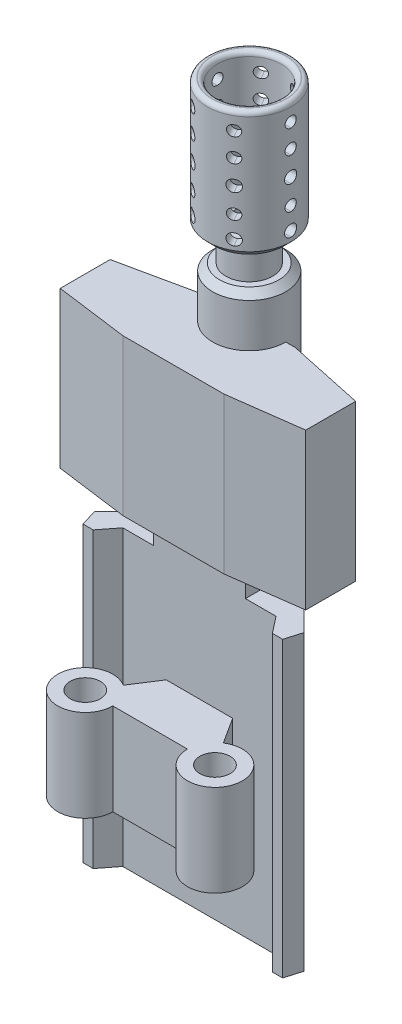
SolidWorks part; units mm, degrees
ref_plane "Front Plane" through (0, 0, 0) normal (0, 0, 1) x (1, 0, 0)
ref_plane "Top Plane" through (0, 0, 0) normal (0, 1, 0) x (1, 0, 0)
ref_plane "Right Plane" through (0, 0, 0) normal (1, 0, 0) x (0, 0, -1)
sketch "Sketch1" plane through (0, 0, 0) normal (0, 1, 0) x (1, 0, 0)
  line L0 (-34.934, 0) -> (-18.634, 0)
  line L1 (-37.6973, 5.0521) -> (-32.621, 12.9754)
  line L2 (-15.8708, 5.0521) -> (-20.9471, 12.9754)
  line L3 (-20.9471, 12.9754) -> (-32.621, 12.9754)
  circle A0 centre (-40.934, 0) radius 3.3
  circle A1 centre (-12.634, 0) radius 3.3
  circle A2 centre (-40.934, 0) radius 6
  circle A3 centre (-12.634, 0) radius 6
extrude "Boss-Extrude1" add sketch "Sketch1" along normal blind 20 contours A2 A0 | A3 L2 L3 L1 A2 L0 | A3 A1
sketch "Sketch2" plane through (0, 20, 0) normal (0, 1, 0) x (1, 0, 0)
  line L0 (-26.784, 0) -> (-26.784, 23.4846)
  line L1 (-34.934, 0) -> (-18.634, 0) construction
  line L2 (-16.6631, 23.4846) -> (-36.9049, 23.4846)
  line L3 (-36.9049, 23.4846) -> (-49.6377, 10.7519)
  line L4 (-43.504, 10.7519) -> (-10.064, 10.7519)
  line L5 (-43.504, 10.7519) -> (-46.3333, 7.1277)
  line L6 (-46.3333, 7.1277) -> (-48.5838, 7.1277)
  line L7 (-48.5838, 7.1277) -> (-49.6377, 10.7519)
  line L8 (-16.6631, 23.4846) -> (-3.9304, 10.7519)
  line L9 (-4.9843, 7.1277) -> (-3.9304, 10.7519)
  line L10 (-7.2348, 7.1277) -> (-4.9843, 7.1277)
  line L11 (-10.064, 10.7519) -> (-7.2348, 7.1277)
  point P15 (-26.784, 10.7519)
extrude "Boss-Extrude2" add sketch "Sketch2" along normal blind 24 and the other way blind 40 contours L7 L6 L5 L4 L0 L2 L3 M14 M13 | L4 L11 L10 L9 L8 L2 L0 M13 M12 | L4 L0 M14 M13 | L0 L4 M12 M13
sketch "Sketch3" plane through (0, 44, 0) normal (0, 1, 0) x (1, 0, 0)
  line L0 (-43.504, 10.7519) -> (-10.064, 10.7519) construction
  line L1 (-36.8287, 21.6332) -> (-16.7394, 21.6332)
  line L2 (-36.8287, 21.6332) -> (-36.8287, 10.7519)
  line L3 (-36.8287, 10.7519) -> (-16.7394, 10.7519)
  line L4 (-16.7394, 21.6332) -> (-16.7394, 10.7519)
  line L5 (-36.8287, 21.6332) -> (-16.7394, 10.7519) construction
  line L6 (-36.8287, 10.7519) -> (-16.7394, 21.6332) construction
  point P0 (-26.784, 16.1925)
extrude "Boss-Extrude3" add sketch "Sketch3" along normal blind 8
sketch "Sketch4" plane through (0, 52, 0) normal (0, 1, 0) x (1, 0, 0)
  line L0 (-16.7394, 21.6332) -> (0, 18.0529)
  line L1 (-37.7974, 5.0654) -> (-15.7706, 5.0654)
  line L2 (-53.5681, 7.1716) -> (-53.5681, 18.0529)
  line L3 (-36.8287, 21.6332) -> (-16.7394, 21.6332)
  line L4 (0, 7.1716) -> (0, 18.0529)
  line L5 (-48.812, 6.5364) -> (-6.8435, 19.5166) construction
  line L6 (-46.7246, 19.5166) -> (-4.7561, 6.5364) construction
  line L7 (-15.7706, 5.0654) -> (0, 7.1716)
  line L8 (-26.784, 21.6332) -> (-26.784, 5.0654)
  line L9 (-37.7974, 5.0654) -> (-53.5681, 7.1716)
  line L10 (-36.8287, 21.6332) -> (-53.5681, 18.0529)
  point P0 (-26.784, 13.3493)
extrude "Boss-Extrude4" add sketch "Sketch4" along normal blind 34 contours L10 L2 L9 L1 L8 M6 M7 | L8 L3 M6 M7 | L8 M5 M7 M4 | L8 L1 L7 L4 L0 M7 M4
sketch "Sketch5" plane through (0, 86, 0) normal (0, 1, 0) x (1, 0, 0)
  line L0 (-16.7394, 21.6332) -> (-36.8287, 21.6332) construction
  circle A0 centre (-26.784, 21.6332) radius 7.9684
extrude "Boss-Extrude5" add sketch "Sketch5" along normal blind 11 and the other way blind 56
chamfer "Chamfer1" distance 5 angle 45 1 edges at (-26.784, 30, -29.6016)
sketch "Sketch6" plane through (0, 97, 0) normal (0, 1, 0) x (1, 0, 0)
  circle A0 centre (-26.784, 21.6332) radius 5.1076
extrude "Boss-Extrude6" add sketch "Sketch6" along normal blind 7
chamfer "Chamfer2" distance 1.5 angle 45 1 edges at (-26.784, 97, -13.6647)
sketch "Sketch7" plane through (0, 104, 0) normal (0, 1, 0) x (1, 0, 0)
  circle A0 centre (-26.784, 21.6332) radius 9.1093
extrude "Boss-Extrude7" add sketch "Sketch7" along normal blind 28
chamfer "Chamfer3" distance 1.5 angle 45 1 edges at (-26.784, 104, -12.5239)
sketch "Sketch8" plane through (0, 132, 0) normal (0, 1, 0) x (1, 0, 0)
  circle A0 centre (-26.784, 21.6332) radius 7.0193
extrude "Cut-Extrude1" cut sketch "Sketch8" against normal blind 27
sketch "Sketch10" plane through (0, 105, 0) normal (0, 1, 0) x (1, 0, 0)
  circle A0 centre (-26.784, 21.6332) radius 3.5658
extrude "Cut-Extrude3" cut sketch "Sketch10" against normal blind 23
fillet "Fillet1" radius 1 2 edges at (-26.784, 132, -12.5239) (-26.784, 132, -14.6139)
ref_plane "Plane1" through (10, 0, 0) normal (1, 0, 0) x (0, 0, -1)
sketch "Sketch11" plane through (10, 0, 0) normal (1, 0, 0) x (0, 0, -1)
  circle A0 centre (21.5594, 128.1583) radius 1.1475
  circle A1 centre (21.5594, 123.0664) radius 1.1584
  circle A2 centre (21.5594, 117.752) radius 1.2567
  circle A3 centre (21.5594, 112.3903) radius 1.159
  circle A4 centre (21.5594, 107.6327) radius 1.2424
extrude "Cut-Extrude4" cut sketch "Sketch11" against normal blind 59
pattern_circular "CirPattern1" count 6 over 360 about axis through (-26.784, 131, -21.6332) along (0, 1, 0) of "Cut-Extrude4"
